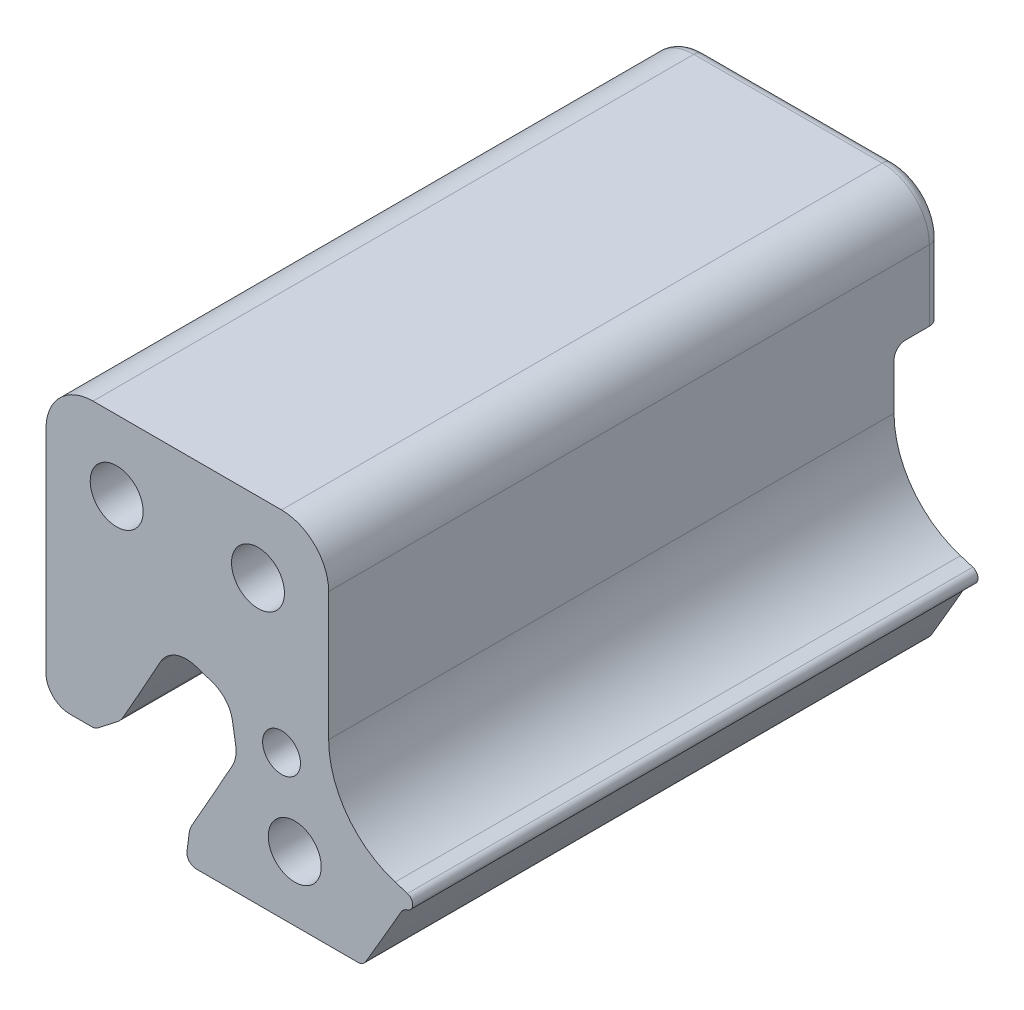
SolidWorks part; units mm, degrees
other "<QU250515L_Punch4[Mounted in the strip]>-<Fillet3>"
ref_plane "Front" through (0, 0, 0) normal (0, 0, 1) x (1, 0, 0)
ref_plane "Top" through (0, 0, 0) normal (0, 1, 0) x (1, 0, 0)
ref_plane "Right" through (0, 0, 0) normal (1, 0, 0) x (0, 0, -1)
inserted part "24051_Punch4[Mounted in the strip]1"
hole_wizard "Hole1" positions "Point_Sketch" profile "Profil_Sketch" legacy
sketch "Point_Sketch" plane through (-840.0201, 65.705, 71.9582) normal (0, 0, -1) x (1, 0, 0)
  point P0 (5.2491, -10.495)
sketch "Profil_Sketch" plane through (-834.771, 76.2, 71.9582) normal (1, 0, 0) x (0, -1, 0)
  line L0 (0, 0) -> (0, 83.2749)
  line L1 (0, 83.2749) -> (1.2065, 82.55)
  line L2 (1.2065, 82.55) -> (1.2065, 41.275)
  line L3 (1.2065, 41.275) -> (2.5527, 41.275)
  line L4 (2.5527, 0) -> (0, 0)
  line L5 (0, -11.3109) -> (0, 121.1557) construction
  line L6 (0, 83.2749) -> (-1.2065, 82.55) construction
  line L7 (2.5527, 41.275) -> (2.5527, 0)
  dimension "Depth" = 82.55
  dimension "Drill Angle" = 118
  dimension "Diameter" = 2.413
  dimension "L1" = 41.275
other "usin_TR460<1>"
hole_wizard "Hole11" positions "Point_Sketch1" profile "Profil_Sketch1" counterbore size "1/4" standard "ANSI Inch"
sketch "Point_Sketch1" plane through (-820.1239, 66.467, -4.2418) normal (0, 0, 1) x (-1, 0, 0)
  point P0 (12.8691, 0.935)
  point P2 (17.8221, -28.529)
  point P4 (36.8721, -28.529)
sketch "Profil_Sketch1" plane through (-832.993, 65.532, -4.2418) normal (1, 0, 0) x (0, 1, 0)
  line L0 (0, 0) -> (0, 76.2)
  line L1 (0, 76.2) -> (3.5687, 76.2)
  line L3 (3.5687, 76.2) -> (3.5687, 22.352)
  line L4 (3.5687, 22.352) -> (5.3594, 22.352)
  line L5 (5.3594, 22.352) -> (5.3594, 0)
  line L7 (5.3594, 0) -> (0, 0)
  line L11 (0, -6.35) -> (0, 107.95) construction
  dimension "Diameter" = 7.1374
  dimension "Thru Hole Depth" = 76.2
  dimension "L1" = 22.352
other "usin_LS160_.25-20x3-SHCS<1>"
sketch "Sketch5" plane through (0, 0, -4.2418) normal (0, 0, 1) x (1, 0, 0)
  circle A1 centre (-856.996, 94.996) radius 5.3594
  circle A2 centre (-856.996, 94.996) radius 5.3594
  circle A3 centre (-837.946, 94.996) radius 5.3594
  circle A4 centre (-837.946, 94.996) radius 5.3594
  dimension "D1" = 0
  dimension "D2" = 0
extrude "Cut-Extrude1" cut sketch "Sketch5" against normal through all
